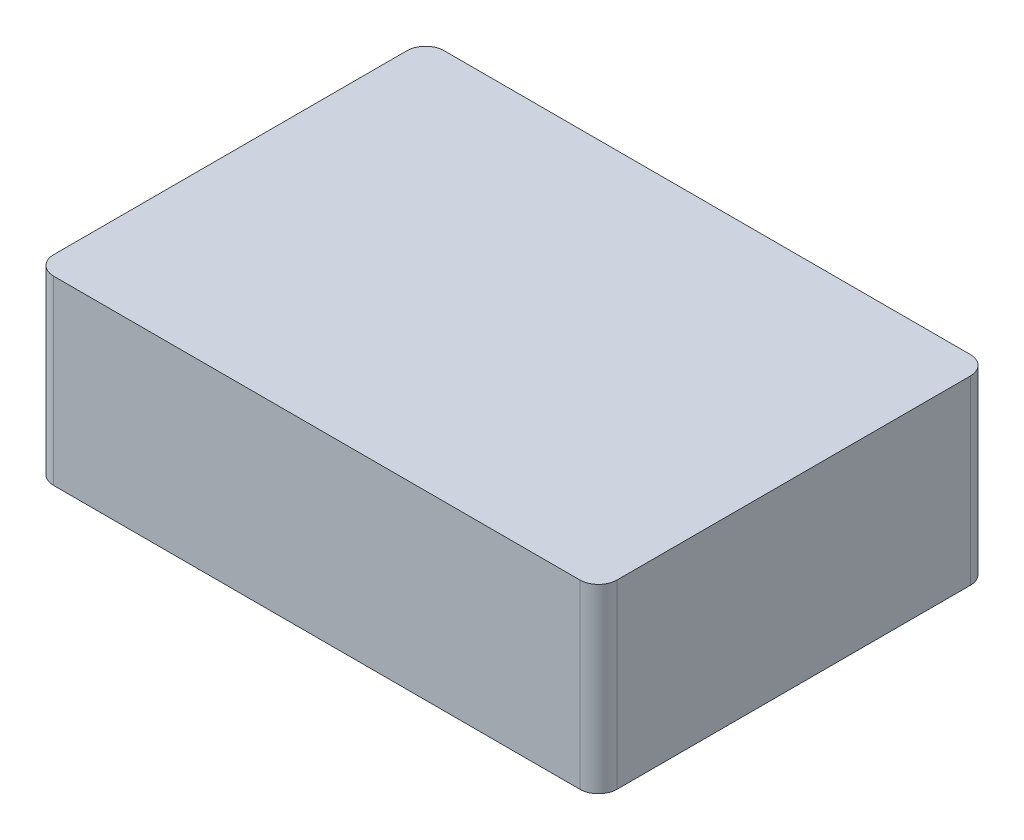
SolidWorks part; units mm, degrees
ref_plane "Front Plane" through (0, 0, 0) normal (0, 0, 1) x (1, 0, 0)
ref_plane "Top Plane" through (0, 0, 0) normal (0, 1, 0) x (1, 0, 0)
ref_plane "Right Plane" through (0, 0, 0) normal (1, 0, 0) x (0, 0, -1)
sketch "Sketch1" plane through (0, 0, 0) normal (0, 1, 0) x (1, 0, 0)
  line L0 (33.401, 12.065) -> (33.401, -12.065) construction
  line L1 (38.481, -26.67) -> (-38.481, -26.67)
  line L2 (38.481, -26.67) -> (38.481, 26.67)
  line L3 (38.481, 26.67) -> (-38.481, 26.67)
  line L4 (-38.481, -26.67) -> (-38.481, 26.67)
  line L5 (38.481, -26.67) -> (-38.481, 26.67) construction
  line L6 (38.481, 26.67) -> (-38.481, -26.67) construction
  line L7 (33.401, -18.415) -> (-33.401, -18.415) construction
  point P0 (0, 0)
  dimension "D1" = 5.08
  dimension "D2" = 8.255
extrude "Boss-Extrude1" add sketch "Sketch1" along normal offset from surface (24.765 mm away) 3.81
fillet "Fillet1" radius 2.54 4 edges at (-38.481, 12.3825, 26.67) (-38.481, 12.3825, -26.67) (38.481, 12.3825, -26.67) (38.481, 12.3825, 26.67)
shell "Shell1" thickness 3.81
sketch "Sketch2" plane through (0, 0, 0) normal (0, -1, 0) x (1, 0, 0)
  line L2 (-33.401, 18.415) -> (33.401, 18.415) construction
  line L4 (33.401, -18.415) -> (-33.401, -18.415) construction
  line L5 (0, 0) -> (0, 26.67) construction
  line L6 (-35.941, 26.67) -> (35.941, 26.67) construction
  line L7 (-33.401, 18.415) -> (-33.401, 12.065) construction
  circle A0 centre (30.988, -22.352) radius 3.175
  circle A1 centre (30.988, 22.352) radius 3.175
  circle A2 centre (-30.988, -22.352) radius 3.175
  circle A3 centre (-30.988, 22.352) radius 3.175
  dimension "D1" = 6.35
  dimension "D2" = 0.762
  dimension "D3" = 0.762
  dimension "D4" = 0.762
extrude "Boss-Extrude2" add sketch "Sketch2" against normal up to surface (20.955 mm away)
hole_wizard "#4 Clearance Hole1" positions "Sketch4" profile "Sketch3" hole size "#4" standard "ANSI Inch"
sketch "Sketch4" plane through (0, 0, 0) normal (0, -1, 0) x (-1, 0, 0)
  point P0 (30.988, -22.352)
  point P3 (-30.988, -22.352)
  point P6 (30.988, 22.352)
  point P9 (-30.988, 22.352)
sketch "Sketch3" plane through (-30.988, 0, 22.352) normal (1, 0, 0) x (0, 0, -1)
  line L0 (0, 0) -> (0, 8.5052)
  line L1 (0, 8.5052) -> (1.4732, 7.62)
  line L2 (1.4732, 7.62) -> (1.4732, 0)
  line L5 (1.4732, 0) -> (0, 0)
  line L10 (0, 8.5052) -> (-1.4732, 7.62) construction
  line L11 (0, -6.35) -> (0, 107.95) construction
  dimension "Hole Dia." = 2.9464
  dimension "Hole Depth" = 7.62
  dimension "Drill Angle" = 118
